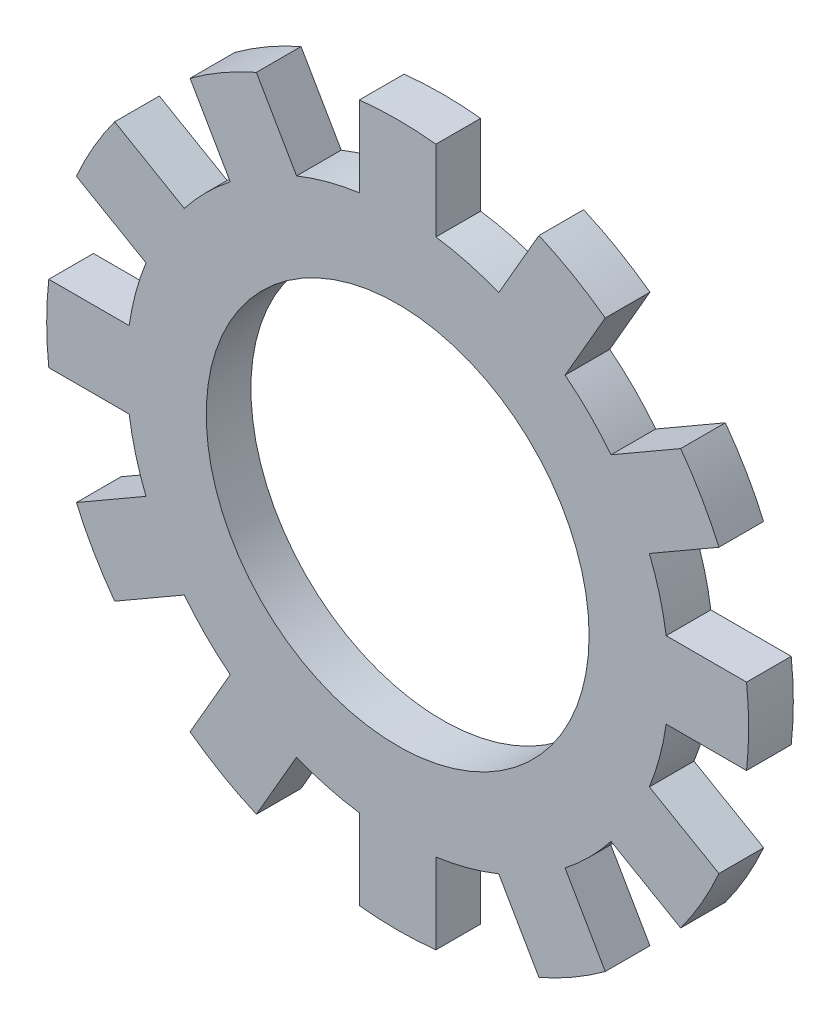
SolidWorks part; units mm, degrees
ref_plane "Front Plane" through (0, 0, 0) normal (0, 0, 1) x (1, 0, 0)
ref_plane "Top Plane" through (0, 0, 0) normal (0, 1, 0) x (1, 0, 0)
ref_plane "Right Plane" through (0, 0, 0) normal (1, 0, 0) x (0, 0, -1)
sketch "Sketch1" plane through (0, 0, 0) normal (0, 0, 1) x (1, 0, 0)
  circle A0 centre (0, 0) radius 3
  circle A1 centre (0, 0) radius 4.25
  dimension "D1" = 6
  dimension "D2" = 8.5
extrude "Boss-Extrude1" add sketch "Sketch1" along normal mid plane 0.7
sketch "Sketch2" plane through (0, 0, 0) normal (0, 0, 1) x (1, 0, 0)
  line L0 (0, 2.6811) -> (0, -2.8425) construction
sketch "Sketch3" plane through (0, 0, 0) normal (0, 0, 1) x (1, 0, 0)
  line L0 (-0.6, 5.4672) -> (-0.6, 4.2074)
  line L2 (0, 2.6811) -> (0, -2.8425) construction
  line L3 (0, 4.25) -> (0, 5.5)
  arc A0 (0, 5.5) -> (-0.6, 5.4672) centre (0, 0) ccw
  arc A1 (0, 4.25) -> (-0.6, 4.2074) centre (0, 0) ccw
  circle A2 centre (0, 0) radius 4.25 construction
  dimension "D2" = 5.5
  dimension "D1" = 0.6
extrude "Boss-Extrude2" add sketch "Sketch3" along normal mid plane 0.7
mirror "Mirror1" about plane through (0, 0, 0) normal (1, 0, 0) of "Boss-Extrude2"
pattern_circular "CirPattern2" count 12 over 360 about axis through (0, 0, 0) along (0, 0, 1) of "Boss-Extrude2", "Mirror1"
